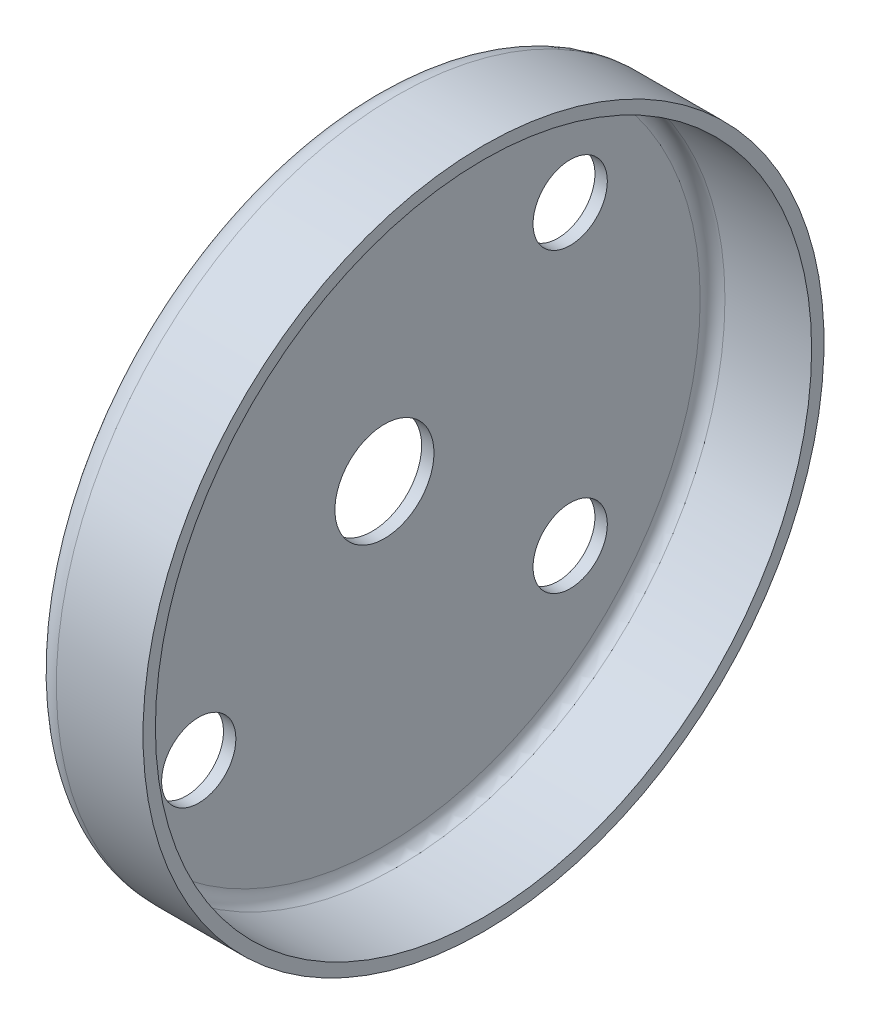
SolidWorks part; units mm, degrees
ref_plane "Front Plane" through (0, 0, 0) normal (0, 0, 1) x (1, 0, 0)
ref_plane "Top Plane" through (0, 0, 0) normal (0, 1, 0) x (1, 0, 0)
ref_plane "Right Plane" through (0, 0, 0) normal (1, 0, 0) x (0, 0, -1)
sketch "Sketch1" plane through (0, 0, 0) normal (1, 0, 0) x (0, 0, -1)
  line L0 (0, 0) -> (0, 12) construction
  line L1 (0, 12) -> (-15, 12) construction
  line L2 (-37.0848, 0) -> (36.9001, 0) construction
  circle A0 centre (0, 0) radius 27.5
  circle A1 centre (0, 0) radius 4
  circle A2 centre (-15, 12) radius 3
  circle A3 centre (-15, -12) radius 3
  circle A4 centre (15, 12) radius 3
  circle A5 centre (15, -12) radius 3
  dimension "D1" = 55
  dimension "D4" = 8
  dimension "D5" = 6
  dimension "D2" = 12
  dimension "D3" = 15
extrude "Boss-Extrude1" add sketch "Sketch1" along normal blind 25
sketch "Sketch4" plane through (0, 0, 0) normal (0, 0, 1) x (1, 0, 0)
  line L0 (9, 27.5) -> (9, -27.5)
  line L1 (25, 27.5) -> (0, 27.5) construction
  line L2 (0, -27.5) -> (25, -27.5) construction
  dimension "D1" = 9
extrude "Cut-Extrude2" cut sketch "Sketch4" against normal through all and the other way through all
fillet "Fillet2" radius 2 1 edges at (0, 0, -27.5)
shell "Shell4" thickness 1
